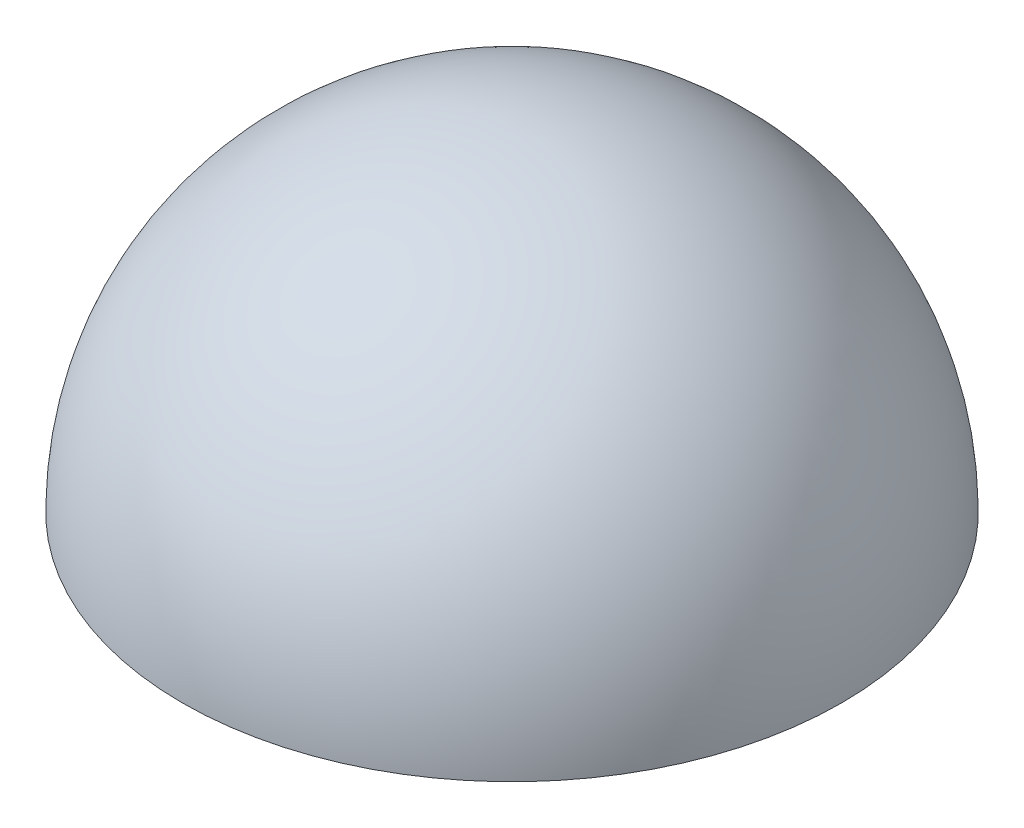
SolidWorks part; units mm, degrees
ref_plane "Front Plane" through (0, 0, 0) normal (0, 0, 1) x (1, 0, 0)
ref_plane "Top Plane" through (0, 0, 0) normal (0, 1, 0) x (1, 0, 0)
ref_plane "Right Plane" through (0, 0, 0) normal (1, 0, 0) x (0, 0, -1)
sketch "Sketch9" plane through (0, 0, 0) normal (0, 0, 1) x (1, 0, 0)
  line L0 (0, 44.45) -> (0, 0)
  line L1 (0, 0) -> (44.45, 0)
  arc A0 (44.45, 0) -> (0, 44.45) centre (0, 0) ccw
  dimension "D1" = 44.45
revolve "Revolve1" add sketch "Sketch9" angle 360 about L0
